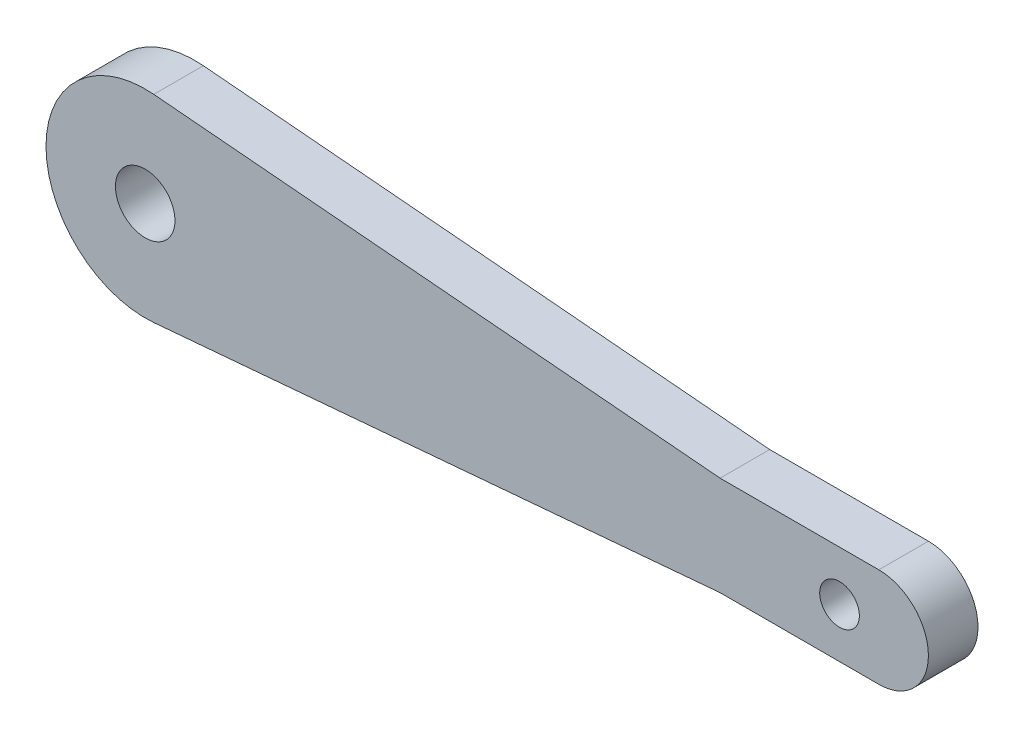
SolidWorks part; units mm, degrees
ref_plane "Front" through (0, 0, 0) normal (0, 0, 1) x (1, 0, 0)
ref_plane "Top" through (0, 0, 0) normal (0, 1, 0) x (1, 0, 0)
ref_plane "Right" through (0, 0, 0) normal (1, 0, 0) x (0, 0, -1)
sketch "Esquisse1" plane through (0, 0, 0) normal (0, 0, 1) x (1, 0, 0)
  line L0 (50, 0) -> (-50, 0) construction
  line L1 (0, 2.5) -> (-8, 2.5)
  line L2 (-8, 2.5) -> (-36.547, 4.9812)
  line L3 (-56.526, 0) -> (11.9699, 0) construction
  line L4 (0, -2.5) -> (-8, -2.5)
  line L5 (-8, -2.5) -> (-36.547, -4.9812)
  arc A0 (-36.547, 4.9812) -> (-36.547, -4.9812) centre (-36.98, 0) ccw
  arc A1 (0, -2.5) -> (0, 2.5) centre (0, 0) ccw
  circle A2 centre (-1.98, 0) radius 1
  circle A3 centre (-36.98, 0) radius 1.5
  dimension "D3" = 5
  dimension "D5" = 2
  dimension "D7" = 3
  dimension "D1" = 8
  dimension "D2" = 5
  dimension "D4" = 36.98
  dimension "D6" = 6.02
extrude "Boss.-Extru.1" add sketch "Esquisse1" along normal mid plane 2.5
